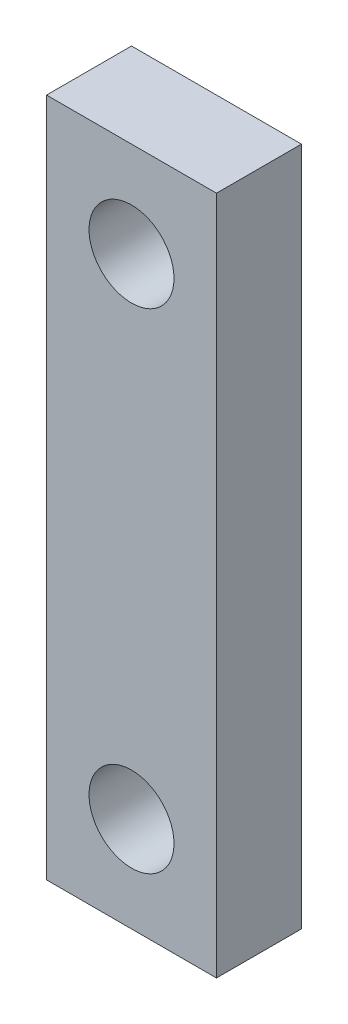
SolidWorks part; units mm, degrees
ref_plane "Front Plane" through (0, 0, 0) normal (0, 0, 1) x (1, 0, 0)
ref_plane "Top Plane" through (0, 0, 0) normal (0, 1, 0) x (1, 0, 0)
ref_plane "Right Plane" through (0, 0, 0) normal (1, 0, 0) x (0, 0, -1)
sketch "Sketch1" plane through (0, 0, 0) normal (0, 0, 1) x (1, 0, 0)
  line L1 (-1.5875, 6.35) -> (1.5875, 6.35)
  line L2 (-1.5875, 6.35) -> (-1.5875, -6.35)
  line L3 (-1.5875, -6.35) -> (1.5875, -6.35)
  line L4 (1.5875, 6.35) -> (1.5875, -6.35)
  line L5 (-1.5875, 6.35) -> (1.5875, -6.35) construction
  line L6 (-1.5875, -6.35) -> (1.5875, 6.35) construction
  point P0 (0, 0)
  dimension "D1" = 12.7
  dimension "D2" = 3.175
extrude "Link" add sketch "Sketch1" along normal blind 1.5875
sketch "Sketch2" plane through (0, 0, 1.5875) normal (0, 0, 1) x (1, 0, 0)
  line L0 (-1.5875, 6.35) -> (-1.5875, -6.35) construction
  circle A0 centre (0, 4.572) radius 0.7938
  circle A1 centre (0, -4.572) radius 0.7938
  point P7 (0, 0)
  point P8 (0, 0)
  dimension "D1" = 1.5875
  dimension "D2" = 1.5875
  dimension "D3" = 4.572
  dimension "D4" = 1.5875
  dimension "D5" = 4.572
extrude "Cut-Extrude1" cut sketch "Sketch2" against normal through all
